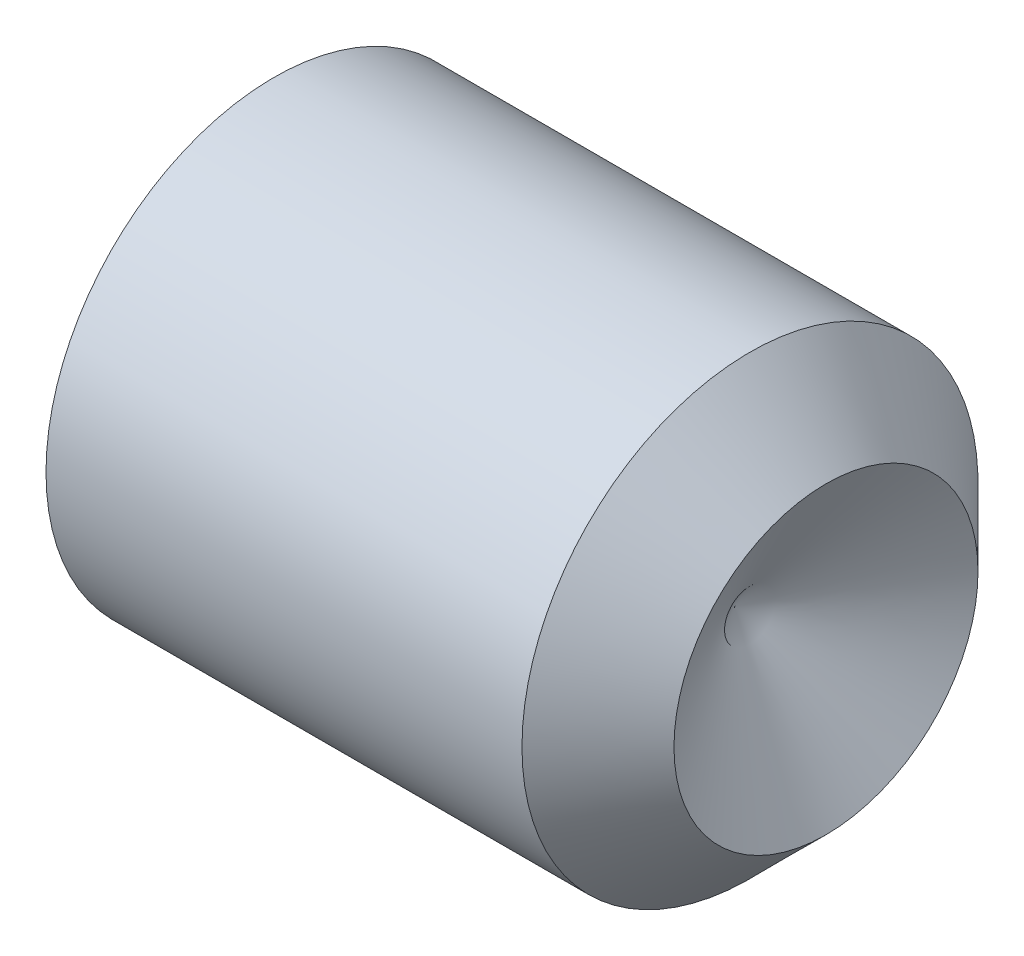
SolidWorks part; units mm, degrees
ref_plane "Plane1" through (0, 0, 0) normal (0, 0, 1) x (1, 0, 0)
ref_plane "Plane2" through (0, 0, 0) normal (0, 1, 0) x (1, 0, 0)
ref_plane "Plane3" through (0, 0, 0) normal (1, 0, 0) x (0, 0, -1)
sketch "BodySke" plane through (0, 0, 0) normal (0, 0, 1) x (1, 0, 0)
  line L0 (0, 0) -> (0, 10.352)
  line L1 (0, 10.352) -> (0.9515, 12)
  line L2 (0.9515, 12) -> (26, 12)
  line L3 (26, 12) -> (30, 8)
  line L4 (25.1931, 0) -> (0, 0)
  line L5 (-12.7, 0) -> (88.9, 0) construction
  line L6 (25.1931, 0) -> (30, 8)
  line L7 (30, 8) -> (30, 17.525) construction
  line L8 (0, -10.352) -> (0.9515, -12) construction
  line L9 (25.1931, 0) -> (30, -8) construction
  line L10 (26, -12) -> (30, -8) construction
  line L11 (3, 15.875) -> (3, -3.175) construction
  dimension "Length" = 30
  dimension "Diameter" = 24
  dimension "Drive_ch_ang" = 60
  dimension "Minor_dia" = 20.704
  dimension "Cup_nose_ang" = 45
  dimension "Cup_ang" = 118
  dimension "Cup_dia" = 16
  dimension "Advance" = 3
revolve "BaseBody" add sketch "BodySke" angle 360 about L5
sketch "Sketch2" plane through (0, 0, 0) normal (-1, 0, 0) x (0, 0, 1)
  line L0 (3.4641, 6) -> (-3.4641, 6)
  line L1 (-3.4641, 6) -> (-6.9282, 0)
  line L2 (3.4641, 6) -> (6.9282, 0)
  line L3 (3.4641, -6) -> (6.9282, 0)
  line L4 (3.4641, -6) -> (-3.4641, -6)
  line L5 (-3.4641, -6) -> (-6.9282, 0)
  dimension "Hex_size" = 12
  dimension "D2" = 6
  dimension "D3" = 6
extrude "Hex" [suppressed] cut sketch "Sketch2" against normal blind 12
sketch "Sketch4" plane through (0, 4.7709, -0.5249) normal (-1, 0, 0) x (0, 0, 1)
  line L0 (0.5249, -4.7709) -> (8.1959, -4.7709)
  line L1 (0.5249, -4.7709) -> (6.6732, -1.2211) construction
  line L2 (0.5249, -4.7709) -> (4.3604, 1.8724)
  line L3 (6.7899, -3.1774) -> (7.8687, -2.5545)
  line L4 (5.0374, -0.142) -> (6.1162, 0.4809)
  arc A0 (6.7899, -3.1774) -> (5.0374, -0.142) centre (0.5249, -4.7709) ccw
  arc A1 (8.1959, -4.7709) -> (7.8687, -2.5545) centre (0.5249, -4.7709) ccw
  arc A2 (4.3604, 1.8724) -> (6.1162, 0.4809) centre (0.5249, -4.7709) cw
  circle A3 centre (0.5249, -4.7709) radius 6.4645 construction
  circle A4 centre (0.5249, -4.7709) radius 7.671 construction
  dimension "D1" = 30
  dimension "Spline_n_dim" = 12.929
  dimension "Spline_m_dim" = 15.342
  dimension "Spline_a_dim" = 60
  dimension "D3" = 1.7525
  dimension "Spline_p_dim" = 3.505
extrude "Spline6" [suppressed] cut sketch "Sketch4" against normal blind 12
pattern_circular "CirPattern1" [suppressed] count 6 every 60 about axis through (-12.7, 0, 0) along (1, 0, 0)
sketch "Sketch5" plane through (0, 1.5227, 6.1981) normal (-1, 0, 0) x (0, 0, 1)
  line L0 (-6.1981, -1.5227) -> (1.4729, -1.5227)
  line L1 (-6.1981, -1.5227) -> (-1.178, 3.4975) construction
  line L2 (-6.1981, -1.5227) -> (-6.1981, 6.1483)
  line L3 (-0.3878, 1.8092) -> (0.3219, 2.5189)
  line L4 (-2.8662, 4.2876) -> (-2.1565, 4.9973)
  line L5 (-2.8662, 4.2876) -> (-0.3878, 1.8092)
  arc A1 (1.4729, -1.5227) -> (0.3219, 2.5189) centre (-6.1981, -1.5227) ccw
  arc A2 (-6.1981, 6.1483) -> (-2.1565, 4.9973) centre (-6.1981, -1.5227) cw
  circle A3 centre (-6.1981, -1.5227) radius 6.4645 construction
  circle A4 centre (-6.1981, -1.5227) radius 7.671 construction
  dimension "D1" = 45
  dimension "Spline_n_dim" = 12.929
  dimension "Spline_m_dim" = 15.342
  dimension "Spline_a_dim" = 90
  dimension "D3" = 1.7525
  dimension "Spline_p_dim" = 3.505
extrude "Spline4" cut sketch "Sketch5" against normal blind 12
pattern_circular "CirPattern2" count 4 every 90 about axis through (0, 0, 0) along (1, 0, 0) of "Spline4"
sketch "ThdSchSke" plane through (0, 0, 0) normal (0, 0, 1) x (1, 0, 0)
  line L0 (0.9515, -10.352) -> (-0.2025, -12)
  line L1 (0.9515, -10.352) -> (2.1054, -12)
  line L2 (2.1054, -12) -> (2.1054, -15)
  line L3 (-3.175, 0) -> (5.1513, 0) construction
  line L4 (0.9515, 12) -> (0.9515, -12) construction
  line L5 (2.1054, -15) -> (-0.2025, -15)
  line L6 (-0.2025, -15) -> (-0.2025, -12)
  dimension "Thread_minor" = 20.704
  dimension "Diameter" = 24
  dimension "SideAngle" = 55
  dimension "VeeAngle" = 70
  dimension "Overcut" = 30
revolve "ThreadSchematic" [suppressed] cut sketch "ThdSchSke" angle 360 about L3
pattern_linear "ThdSchPat" [suppressed]
equation "\"D2@Sketch2\" = \"Hex_size@Sketch2\" / 2"
equation "\"D3@Sketch2\" = \"Hex_size@Sketch2\" / 2"
equation "\"Thread_minor@ThreadCosmetic\" = \"Minor_dia@BodySke\""
equation "\"D1@Sketch4\" = \"Spline_a_dim@Sketch4\" / 2"
equation "\"D3@Sketch4\" = \"Spline_p_dim@Sketch4\" / 2"
equation "\"D2@CirPattern1\" = \"Spline_a_dim@Sketch4\""
equation "\"Num_teeth@CirPattern1\" = 360 / \"D2@CirPattern1\""
equation "\"Spline_a_dim@Sketch5\" = 90"
equation "\"Spline_p_dim@Sketch5\" = \"Spline_p_dim@Sketch4\""
equation "\"Spline_m_dim@Sketch5\" = \"Spline_m_dim@Sketch4\""
equation "\"Spline_n_dim@Sketch5\" = \"Spline_n_dim@Sketch4\""
equation "\"D1@Sketch5\" = \"Spline_a_dim@Sketch5\" / 2"
equation "\"D3@Sketch5\" = \"Spline_p_dim@Sketch5\" / 2"
equation "\"Key_eng@Spline4\" = \"Key_eng@Spline6\""
equation "\"Thread_minor@ThdSchSke\" = \"Thread_minor@ThreadCosmetic\""
equation "\"Diameter@ThdSchSke\" = \"Diameter@BodySke\""
equation "\"Overcut@ThdSchSke\" = \"Diameter@BodySke\" * 1.25"
equation "\"Num_threads@ThdSchPat\" = int( (\"Length@BodySke\" - ( ( ( \"Diameter@BodySke\" - \"Minor_dia@BodySke\" ) * 0.5 ) / tan( \"Drive_ch_ang@BodySke\" * 0.017453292 ) ) - ( ( ( \"Diameter@BodySke\" - \"Cup_dia@BodySk"
equation "\"Advance@ThdSchPat\" = (\"Length@BodySke\" - ( ( ( \"Diameter@BodySke\" - \"Minor_dia@BodySke\" ) * 0.5 ) / tan( \"Drive_ch_ang@BodySke\" * 0.017453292 ) ) - ( ( ( \"Diameter@BodySke\" - \"Cup_dia@BodySke\" ) * 0."
equation "' \"Num_threads@ThdSchPat\" = \"Num_threads@ThdSchPat\" - sgn( \"Num_threads@ThdSchPat\" - 1) '---chamfered tips only---"
